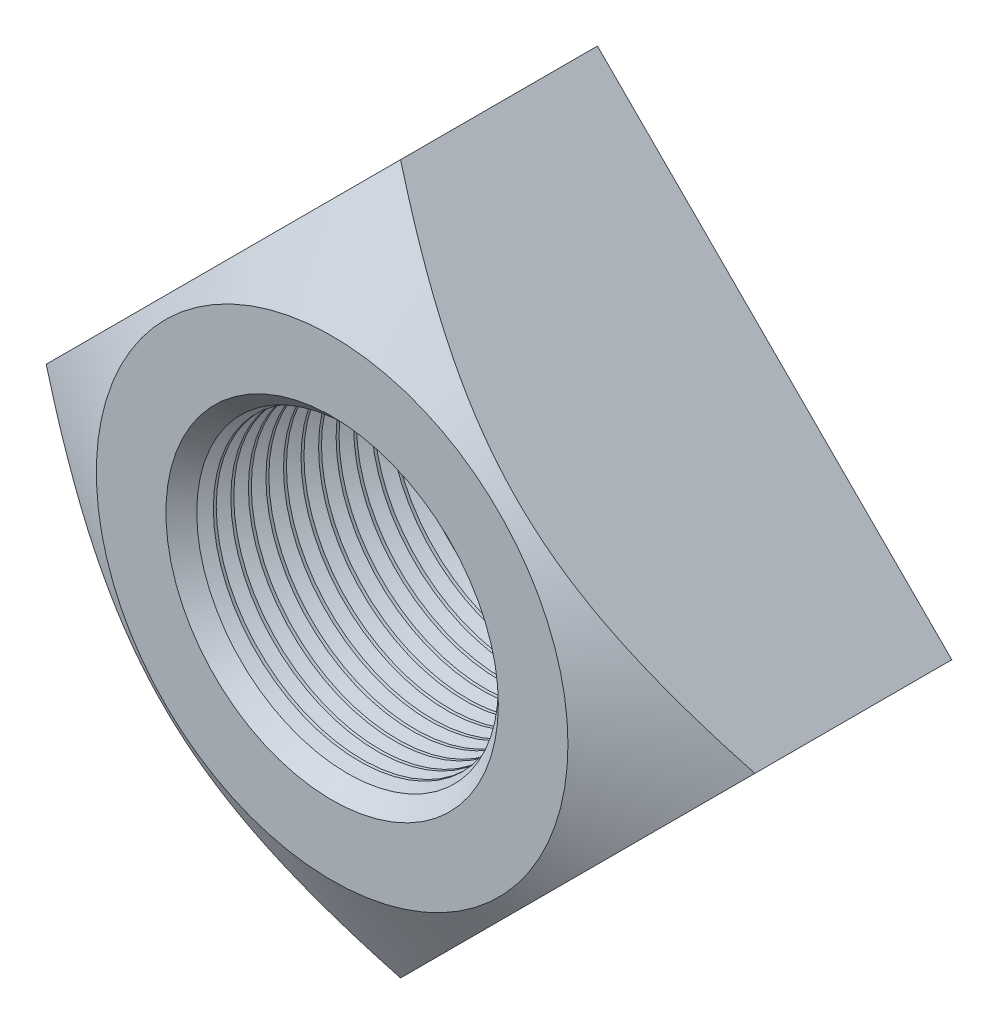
SolidWorks part; units mm, degrees
ref_plane "Front" through (0, 0, 0) normal (0, 0, 1) x (1, 0, 0)
ref_plane "Top" through (0, 0, 0) normal (0, 1, 0) x (1, 0, 0)
ref_plane "Right" through (0, 0, 0) normal (1, 0, 0) x (0, 0, -1)
sketch "Sketch1" plane through (0, 0, 0) normal (0, 0, 1) x (1, 0, 0)
  line L1 (0, 24.0416) -> (-24.0416, 0)
  line L2 (-24.0416, 0) -> (0, -24.0416)
  line L3 (0, -24.0416) -> (24.0416, 0)
  line L4 (24.0416, 0) -> (0, 24.0416)
  circle A0 centre (0, 0) radius 17 construction
  circle A1 centre (0, 0) radius 9.9175
  dimension "D1" = 19.835
  dimension "s" = 34
extrude "BaseNut" add sketch "Sketch1" against normal blind 18
sketch "Sketch2" plane through (0, 0, 0) normal (0, 1, 0) x (-1, 0, 0)
  line L0 (0, 6.7358) -> (0, -22.2595) construction
  line L2 (16, 0) -> (24.0416, 0)
  line L4 (24.0416, 0) -> (24.0416, -4.6428)
  line L6 (24.0416, -4.6428) -> (16, 0)
  dimension "D1" = 32
  dimension "D2" = 30
revolve "Single-Chamfer" cut sketch "Sketch2" angle 360 about L0
chamfer "Chamfer1" distance 1.36 angle 45 2 edges at (9.9175, 0, -18) (9.9175, 0, 0)
sketch "Sketch3" plane through (0, 0, 0) normal (0, 1, 0) x (1, 0, 0)
  line L0 (0, 25.6396) -> (0, -7.8226) construction
  line L1 (8.9258, 1.8559) -> (9.9175, 1.8559)
  line L2 (9.9175, 1.8559) -> (10.7764, 1.36)
  line L3 (10.7764, 1.36) -> (9.9175, 0.8641)
  line L4 (9.9175, 0.8641) -> (8.9258, 0.8641)
  line L5 (8.9258, 0.8641) -> (8.9258, 1.8559)
  line L6 (9.9175, 1.36) -> (-9.9175, 1.36) construction
  dimension "D1" = 0.9918
  dimension "D2" = 19.835
revolve "Cut-Revolve10" cut sketch "Sketch3" angle 360 about L0
pattern_linear "LPattern10" count 13 spacing 1.1901 along (0, 0, -1) of "Cut-Revolve10"
equation "\"D1@Sketch2\" = \"s@Sketch1\"-2"
equation "\"D1@Chamfer1\" = \"s@Sketch1\" / 25"
equation "\"D2@Sketch3\" = \"D1@Sketch1\""
equation "\"D1@Sketch3\" = ( \"D1@Sketch1\" )  / 20"
equation "\"D3@LPattern10\" = \"D1@Sketch3\" * 1.2"
equation "\"D1@LPattern10\" = (  \"m@BaseNut\" -  ( 2 * \"D1@Chamfer1\" )  )  / \"D3@LPattern10\""
